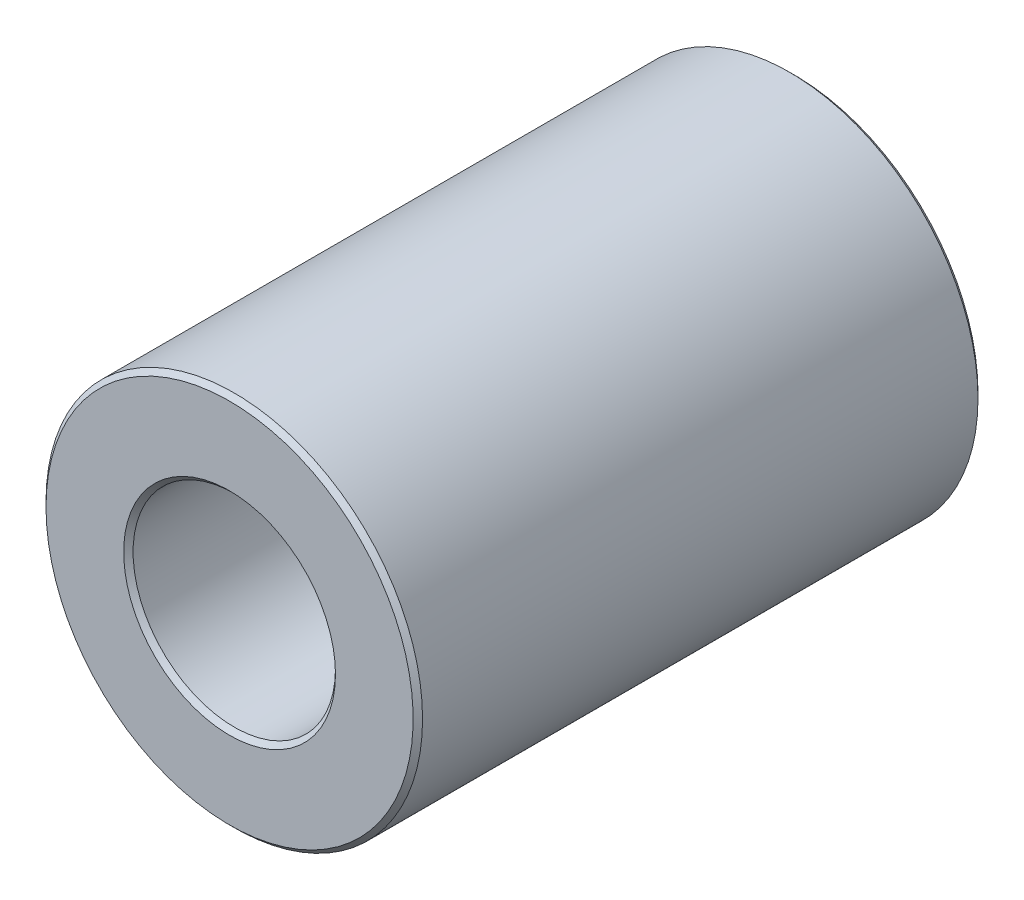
SolidWorks part; units mm, degrees
ref_plane "Front Plane" through (0, 0, 0) normal (0, 0, 1) x (1, 0, 0)
ref_plane "Top Plane" through (0, 0, 0) normal (0, 1, 0) x (1, 0, 0)
ref_plane "Right Plane" through (0, 0, 0) normal (1, 0, 0) x (0, 0, -1)
sketch "Sketch1" plane through (0, 0, 0) normal (0, 0, 1) x (1, 0, 0)
  circle A0 centre (0, 0) radius 4
  circle A1 centre (0, 0) radius 2.15
  dimension "D1" = 8
  dimension "D2" = 4.3
extrude "Boss-Extrude2" add sketch "Sketch1" along normal mid plane 12
chamfer "Chamfer3" distance 0.1 angle 45 4 edges at (4, 0, 6) (4, 0, -6) (2.15, 0, -6) (2.15, 0, 6)
